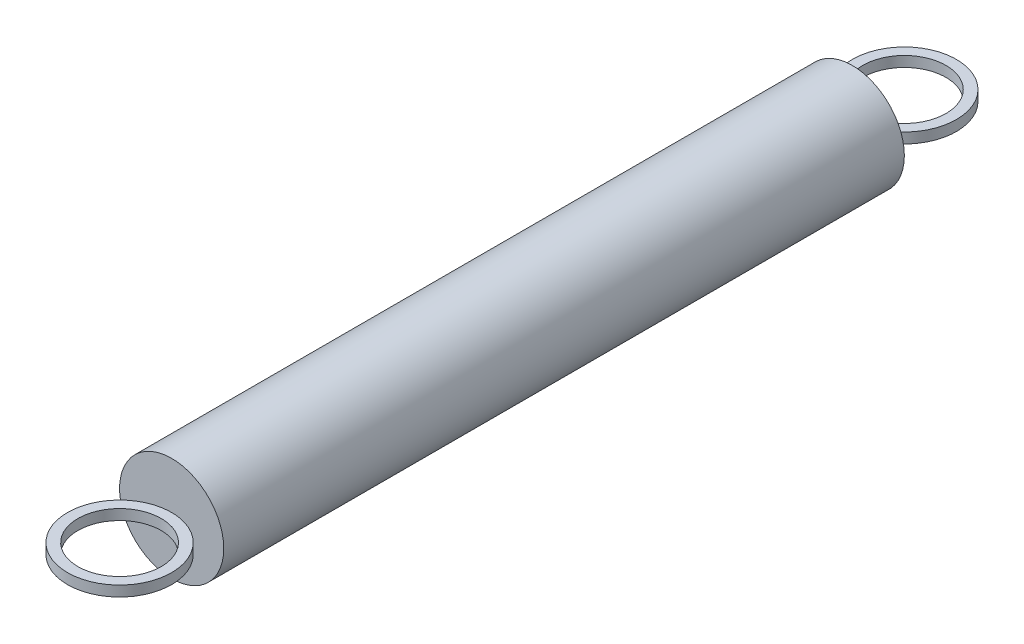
SolidWorks part; units mm, degrees
ref_plane "Front Plane" through (0, 0, 0) normal (0, 0, 1) x (1, 0, 0)
ref_plane "Top Plane" through (0, 0, 0) normal (0, 1, 0) x (1, 0, 0)
ref_plane "Right Plane" through (0, 0, 0) normal (1, 0, 0) x (0, 0, -1)
sketch "Sketch1" plane through (0, 0, 0) normal (0, 0, 1) x (1, 0, 0)
  circle A0 centre (0, 0) radius 2.286
  dimension "D1" = 4.572
extrude "Extrude1" add sketch "Sketch1" along normal mid plane 29.8704
sketch "Sketch2" plane through (0, 0, 0) normal (0, 1, 0) x (1, 0, 0)
  line L0 (2.286, 14.9352) -> (-2.286, 14.9352) construction
  line L2 (-3.1494, 0) -> (3.0916, 0) construction
  circle A0 centre (0, 17.2212) radius 1.8288
  circle A1 centre (0, 17.2212) radius 2.286
  circle A2 centre (0, -17.2212) radius 1.8288
  circle A3 centre (0, -17.2212) radius 2.286
  point P9 (0, 19.5072)
  point P10 (0, -19.5072)
  dimension "D1" = 3.6576
  dimension "D3" = 4.572
extrude "Extrude2" add sketch "Sketch2" along normal mid plane 0.4572
